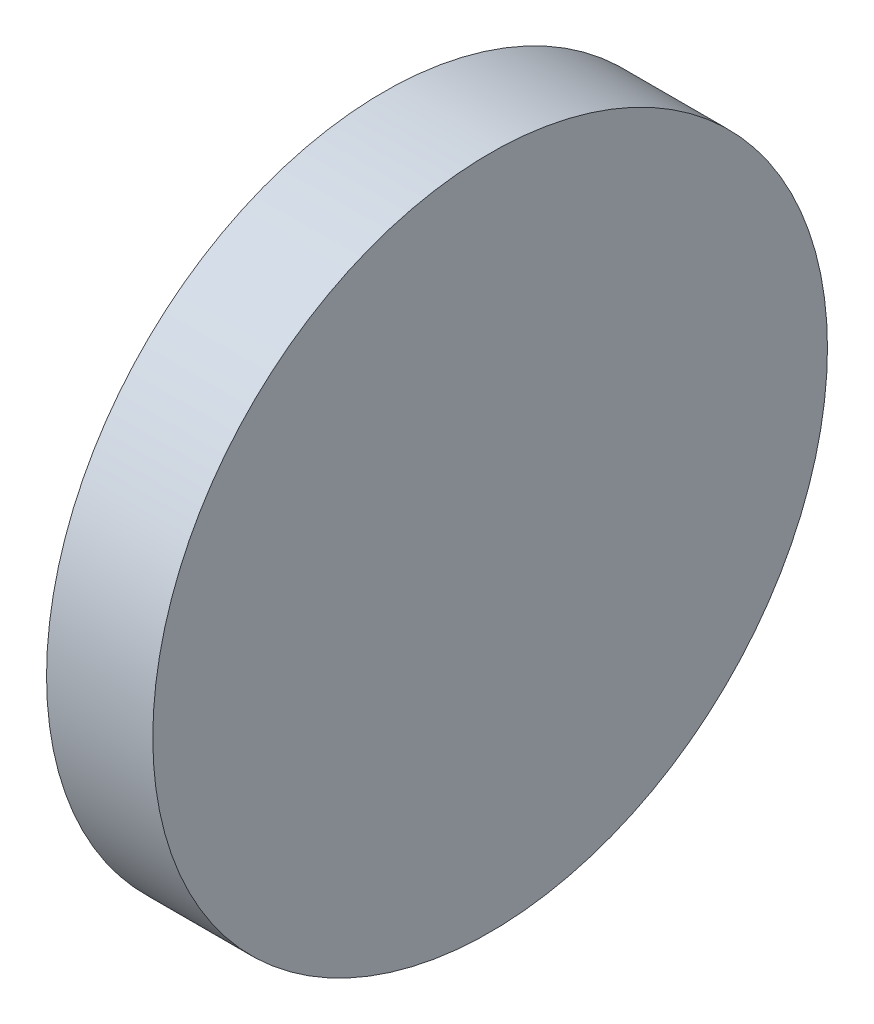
SolidWorks part; units mm, degrees
ref_plane "Front Plane" through (0, 0, 0) normal (0, 0, 1) x (1, 0, 0)
ref_plane "Top Plane" through (0, 0, 0) normal (0, 1, 0) x (1, 0, 0)
ref_plane "Right Plane" through (0, 0, 0) normal (1, 0, 0) x (0, 0, -1)
sketch "Sketch1" plane through (0, 0, 0) normal (1, 0, 0) x (0, 0, -1)
  circle A0 centre (0, 0) radius 31.75
  dimension "D1" = 63.5
extrude "Boss-Extrude1" add sketch "Sketch1" along normal mid plane 10
